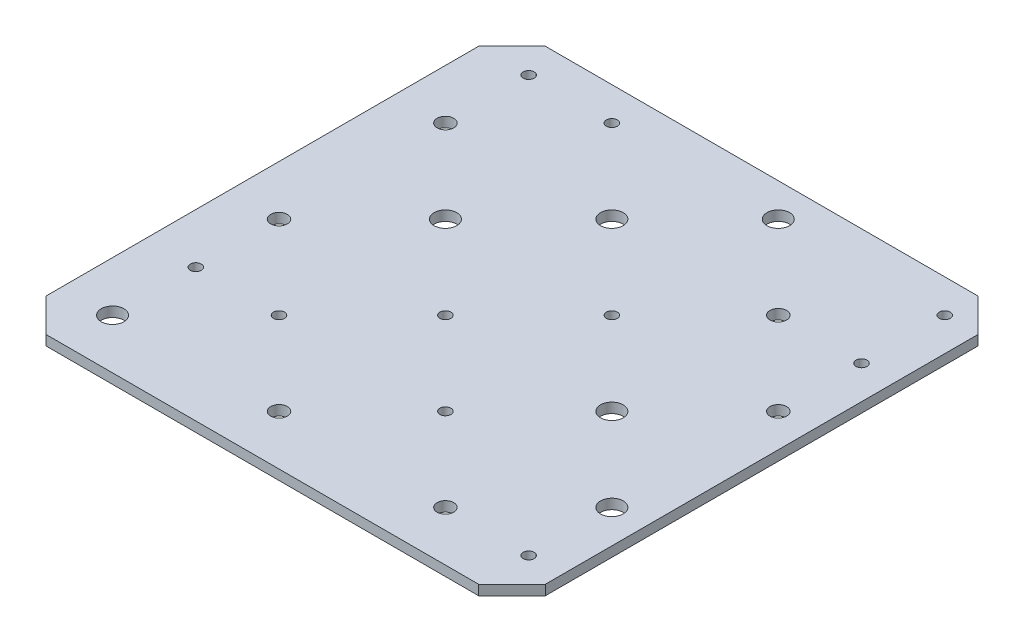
SolidWorks part; units mm, degrees
ref_plane "Front Plane" through (0, 0, 0) normal (0, 0, 1) x (1, 0, 0)
ref_plane "Top Plane" through (0, 0, 0) normal (0, 1, 0) x (1, 0, 0)
ref_plane "Right Plane" through (0, 0, 0) normal (1, 0, 0) x (0, 0, -1)
sketch "Sketch2" plane through (0, 0, 0) normal (0, 1, 0) x (1, 0, 0)
  line L1 (-75, -75) -> (75, -75)
  line L2 (-75, -75) -> (-75, 75)
  line L3 (-75, 75) -> (75, 75)
  line L4 (75, -75) -> (75, 75)
  line L5 (-75, -75) -> (75, 75) construction
  line L6 (-75, 75) -> (75, -75) construction
  point P0 (0, 0)
  dimension "D1" = 150
  dimension "D2" = 150
extrude "Boss-Extrude2" add sketch "Sketch2" along normal blind 3
hole_wizard "Tap Drill for M4x0.7 Tap1" positions "Sketch3" profile "Sketch4" hole size "M4x0.7" standard "ANSI Metric"
sketch "Sketch3" plane through (0, 3, 0) normal (0, 1, 0) x (1, 0, 0)
  line L0 (75, 75) -> (-75, 75) construction
  line L1 (75, -75) -> (75, 75) construction
  point P0 (-35, 65)
  point P2 (65, 65)
  point P4 (15, 15)
  point P6 (-35, -35)
  point P8 (-10, -10)
  point P10 (15, -35)
  dimension "D1" = 10
  dimension "D2" = 10
  dimension "D3" = 10
  dimension "D4" = 100
  dimension "D5" = 50
  dimension "D6" = 50
  dimension "D7" = 50
  dimension "D8" = 50
  dimension "D9" = 50
  dimension "D10" = 25
  dimension "D11" = 25
  dimension "D12" = 60
sketch "Sketch4" plane through (-35, 3, -65) normal (1, 0, 0) x (0, 0, 1)
  line L0 (0, 0) -> (0, 3)
  line L1 (0, 3) -> (1.65, 3)
  line L2 (1.65, 3) -> (1.65, 0)
  line L5 (1.65, 0) -> (0, 0)
  line L11 (0, -6.35) -> (0, 107.95) construction
  dimension "Thru Hole Dia." = 3.3
  dimension "Thru Hole Depth" = 3
hole_wizard "Tap Drill for M6x1.0 Tap1" positions "Sketch5" profile "Sketch6" hole size "M6x1.0" standard "ANSI Metric"
sketch "Sketch5" plane through (0, 3, 0) normal (0, 1, 0) x (1, 0, 0)
  line L0 (75, 75) -> (-75, 75) construction
  line L1 (75, -75) -> (75, 75) construction
  circle A0 centre (15, -35) radius 1.65 construction
  point P0 (40, 40)
  point P2 (-60, 40)
  point P4 (65, 15)
  point P6 (40, -60)
  point P8 (-10, -60)
  point P10 (-60, -10)
  point P27 (176.1878, 220.1777)
  dimension "D1" = 35
  dimension "D2" = 35
  dimension "D3" = 135
  dimension "D4" = 35
  dimension "D5" = 10
  dimension "D6" = 60
  dimension "D7" = 25
  dimension "D8" = 25
  dimension "D9" = 50
  dimension "D10" = 35
  dimension "D11" = 50
  dimension "D12" = 135
sketch "Sketch6" plane through (40, 3, -40) normal (1, 0, 0) x (0, 0, 1)
  line L0 (0, 0) -> (0, 3)
  line L1 (0, 3) -> (2.5, 3)
  line L2 (2.5, 3) -> (2.5, 0)
  line L5 (2.5, 0) -> (0, 0)
  line L11 (0, -6.35) -> (0, 107.95) construction
  dimension "Thru Hole Dia." = 5
  dimension "Thru Hole Depth" = 3
hole_wizard "Tap Drill for M8x1.25 Tap1" positions "Sketch7" profile "Sketch8" hole size "M8x1.25" standard "ANSI Metric"
sketch "Sketch7" plane through (0, 3, 0) normal (0, 1, 0) x (1, 0, 0)
  line L0 (75, 75) -> (-75, 75) construction
  line L1 (75, -75) -> (75, 75) construction
  circle A0 centre (65, 65) radius 1.65 construction
  point P0 (65, -35)
  point P2 (40, -10)
  point P4 (-10, 40)
  point P6 (15, 65)
  point P8 (-60, -60)
  point P10 (-35, 15)
  dimension "D1" = 10
  dimension "D2" = 50
  dimension "D3" = 25
  dimension "D4" = 25
  dimension "D5" = 60
  dimension "D6" = 110
  dimension "D7" = 25
  dimension "D8" = 35
  dimension "D9" = 10
  dimension "D10" = 110
  dimension "D11" = 25
  dimension "D12" = 135
sketch "Sketch8" plane through (65, 3, 35) normal (1, 0, 0) x (0, 0, 1)
  line L0 (0, 0) -> (0, 3)
  line L1 (0, 3) -> (3.4, 3)
  line L2 (3.4, 3) -> (3.4, 0)
  line L5 (3.4, 0) -> (0, 0)
  line L11 (0, -6.35) -> (0, 107.95) construction
  dimension "Thru Hole Dia." = 6.8
  dimension "Thru Hole Depth" = 3
hole_wizard "Tap Drill for M4x0.7 Tap2" positions "Sketch9" profile "Sketch10" hole size "M4x0.7" standard "ANSI Metric"
sketch "Sketch9" plane through (0, 3, 0) normal (0, 1, 0) x (1, 0, 0)
  line L0 (-75, 75) -> (-75, -75) construction
  line L1 (75, 75) -> (-75, 75) construction
  line L2 (75, -75) -> (75, 75) construction
  line L4 (-75, -75) -> (75, -75) construction
  point P0 (-60, 65)
  point P2 (65, 40)
  point P4 (-60, -35)
  point P6 (65, -60)
  dimension "D1" = 15
  dimension "D2" = 10
  dimension "D3" = 35
  dimension "D4" = 10
  dimension "D5" = 10
  dimension "D6" = 15
  dimension "D7" = 15
  dimension "D8" = 40
sketch "Sketch10" plane through (-60, 3, -65) normal (1, 0, 0) x (0, 0, 1)
  line L0 (0, 0) -> (0, 3)
  line L1 (0, 3) -> (1.65, 3)
  line L2 (1.65, 3) -> (1.65, 0)
  line L5 (1.65, 0) -> (0, 0)
  line L11 (0, -6.35) -> (0, 107.95) construction
  dimension "Thru Hole Dia." = 3.3
  dimension "Thru Hole Depth" = 3
chamfer "Chamfer1" distance 10 angle 45 4 edges at (-75, 1.5, -75) (-75, 1.5, 75) (75, 1.5, -75) (75, 1.5, 75)
